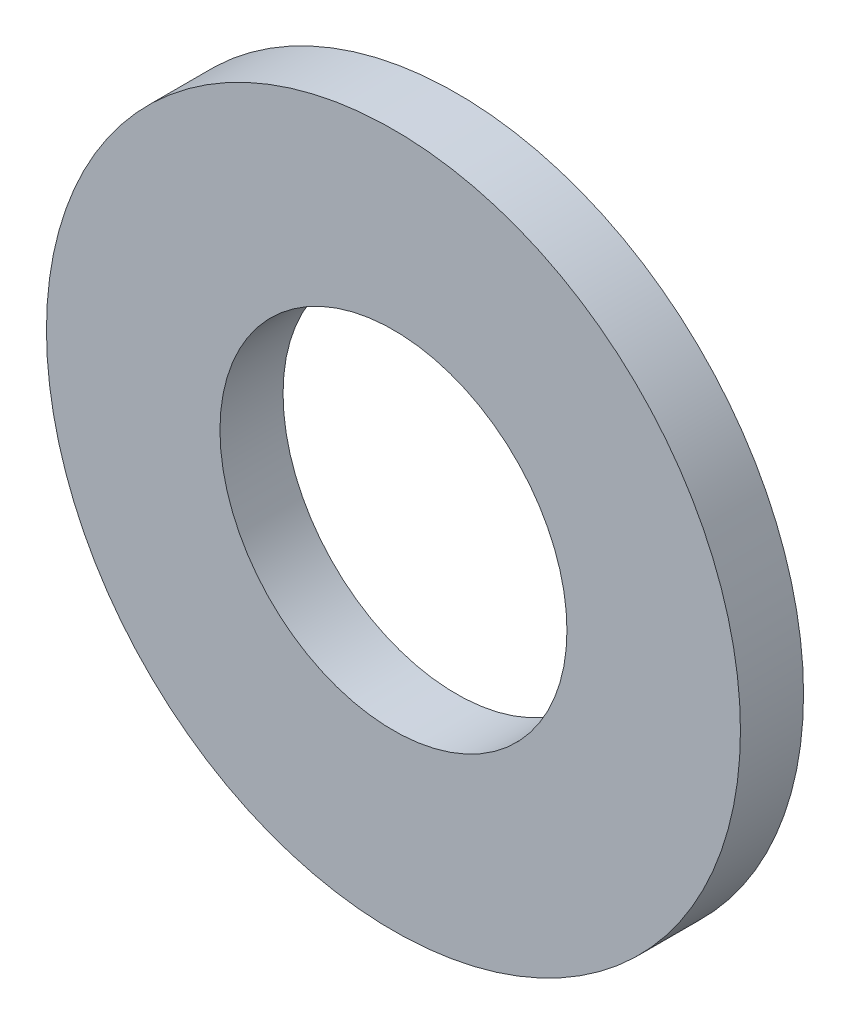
SolidWorks part; units mm, degrees
ref_plane "Plan de face" through (0, 0, 0) normal (0, 0, 1) x (1, 0, 0)
ref_plane "Plan de dessus" through (0, 0, 0) normal (0, 1, 0) x (1, 0, 0)
ref_plane "Plan de droite" through (0, 0, 0) normal (1, 0, 0) x (0, 0, -1)
sketch "Esquisse1" plane through (0, 0, 0) normal (0, 1, 0) x (1, 0, 0)
  line L0 (5.5, -2) -> (11, -2)
  line L1 (11, -2) -> (11, 0)
  line L2 (11, 0) -> (5.5, 0)
  line L3 (5.5, 0) -> (5.5, -2)
  line L4 (0, 0) -> (0, -2) construction
revolve "Révolution1" add sketch "Esquisse1" angle 360 about L4
